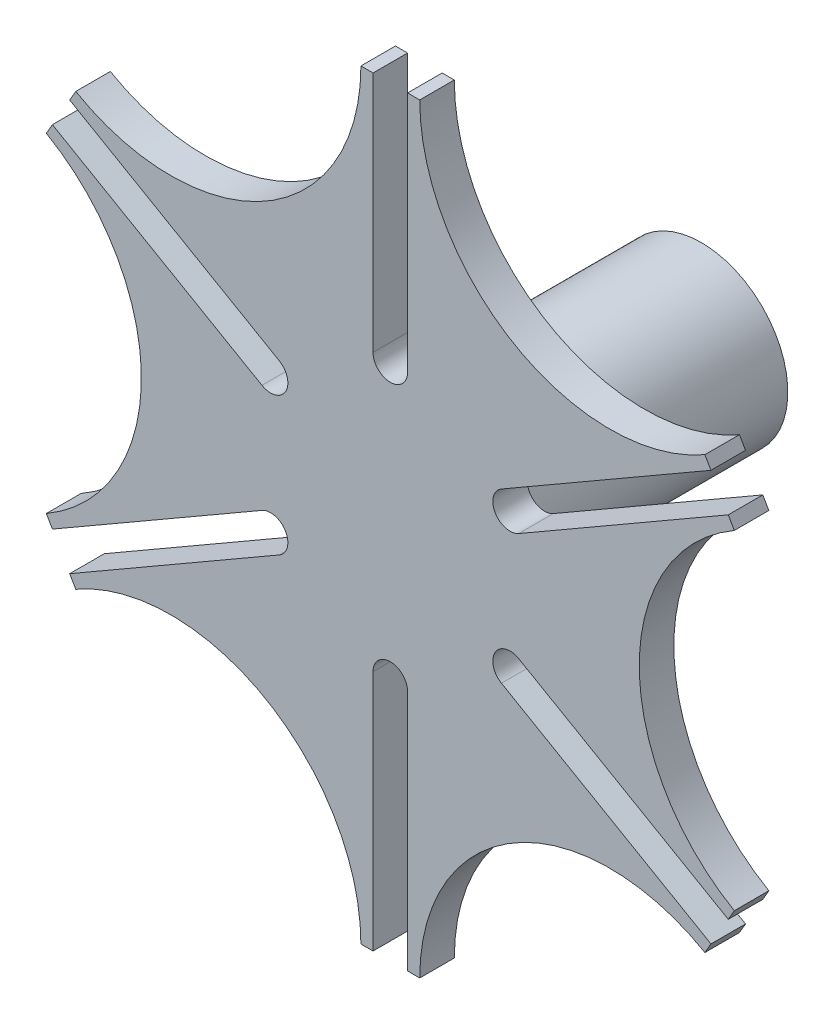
SolidWorks part; units mm, degrees
ref_plane "Front" through (0, 0, 0) normal (0, 0, 1) x (1, 0, 0)
ref_plane "Top" through (0, 0, 0) normal (0, 1, 0) x (1, 0, 0)
ref_plane "Right" through (0, 0, 0) normal (1, 0, 0) x (0, 0, -1)
sketch "Sketch1" plane through (0, 0, 0) normal (0, 0, 1) x (1, 0, 0)
  line L1 (80.6558, 139.7) -> (-80.6558, 139.7)
  line L2 (-80.6558, 139.7) -> (-161.3117, 0)
  line L3 (-161.3117, 0) -> (-80.6558, -139.7)
  line L4 (-80.6558, -139.7) -> (80.6558, -139.7)
  line L5 (80.6558, -139.7) -> (161.3117, 0)
  line L6 (161.3117, 0) -> (80.6558, 139.7)
  line L8 (-6.35, 139.7) -> (-6.35, 50.8) construction
  line L10 (6.35, 139.7) -> (6.35, 50.8) construction
  circle A0 centre (0, 0) radius 139.7 construction
  arc A1 (-10.8058, 139.7) -> (-115.5808, 79.2081) centre (-80.6558, 139.7) cw construction
  arc A2 (-6.35, 50.8) -> (6.35, 50.8) centre (0, 50.8) ccw construction
  dimension "D1" = 279.4
  dimension "D2" = 69.85
  dimension "D4" = 88.9
  dimension "D3" = 12.7
extrude "Base-Extrude" add sketch "Sketch1" along normal blind 12.7
sketch "Sketch2" plane through (0, 0, 0) normal (0, 0, -1) x (-1, 0, 0)
  circle A0 centre (0, 0) radius 31.75
  dimension "D1" = 63.5
extrude "Boss-Extrude1" add sketch "Sketch2" along normal blind 101.6
sketch "Sketch3" plane through (0, 0, 12.7) normal (0, 0, 1) x (1, 0, 0)
  line L0 (6.35, 139.7) -> (6.35, 50.8) construction
  line L1 (-6.35, 139.7) -> (-6.35, 50.8) construction
  line L2 (6.35, 139.7) -> (6.35, 50.8)
  line L3 (-6.35, 139.7) -> (-6.35, 50.8)
  line L4 (-80.6558, 139.7) -> (-161.3117, 0) construction
  line L5 (80.6558, 139.7) -> (-80.6558, 139.7) construction
  line L6 (-80.6558, 139.7) -> (-115.5808, 79.2081)
  line L7 (6.35, 139.7) -> (-6.35, 139.7)
  line L8 (-10.8058, 139.7) -> (-80.6558, 139.7)
  arc A0 (-115.5808, 79.2081) -> (-10.8058, 139.7) centre (-80.6558, 139.7) ccw construction
  arc A1 (-6.35, 50.8) -> (6.35, 50.8) centre (0, 50.8) ccw construction
  arc A2 (-115.5808, 79.2081) -> (-10.8058, 139.7) centre (-80.6558, 139.7) ccw
  arc A3 (-6.35, 50.8) -> (6.35, 50.8) centre (0, 50.8) ccw
extrude "Cut-Extrude1" cut sketch "Sketch3" against normal through all
pattern_circular "CirPattern1" count 6 over 360 about axis through (0, 0, 0) along (0, 0, 1) of "Cut-Extrude1"
